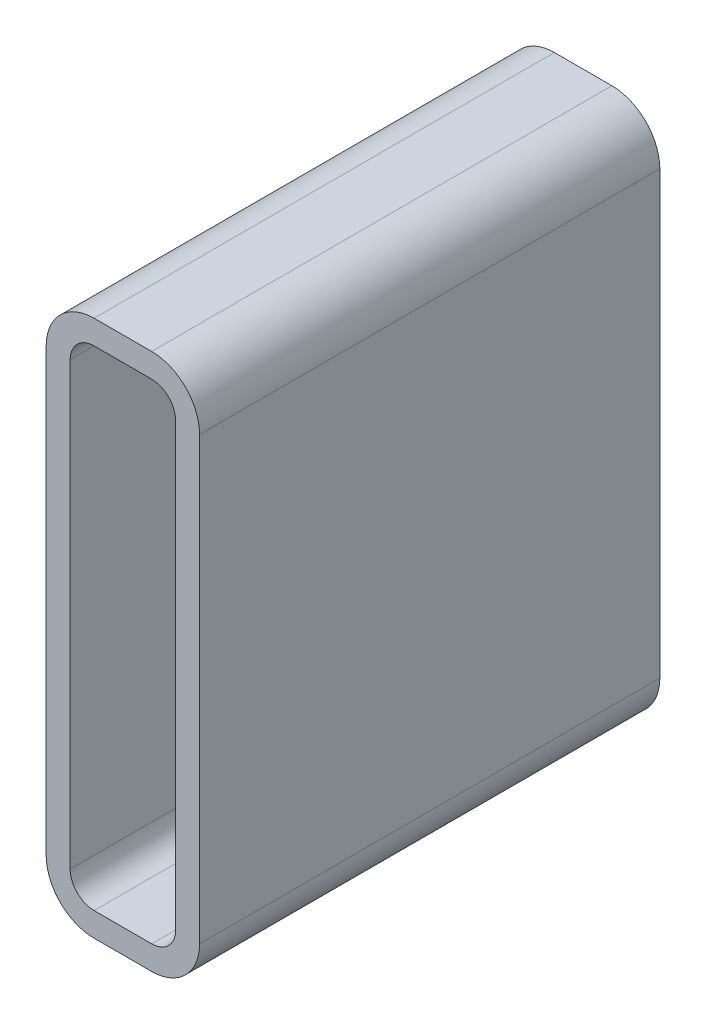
SolidWorks part; units mm, degrees
ref_plane "Front Plane" through (0, 0, 0) normal (0, 0, 1) x (1, 0, 0)
ref_plane "Top Plane" through (0, 0, 0) normal (0, 1, 0) x (1, 0, 0)
ref_plane "Right Plane" through (0, 0, 0) normal (1, 0, 0) x (0, 0, -1)
sketch "Sketch1" plane through (0, 0, 0) normal (0, 0, 1) x (1, 0, 0)
sketch_block_instance "HSS14x4x0.625-1"
sketch_block "HSS14x4x0.625"
extrude "Boss-Extrude1" add sketch "Sketch1" along normal blind 304.8
